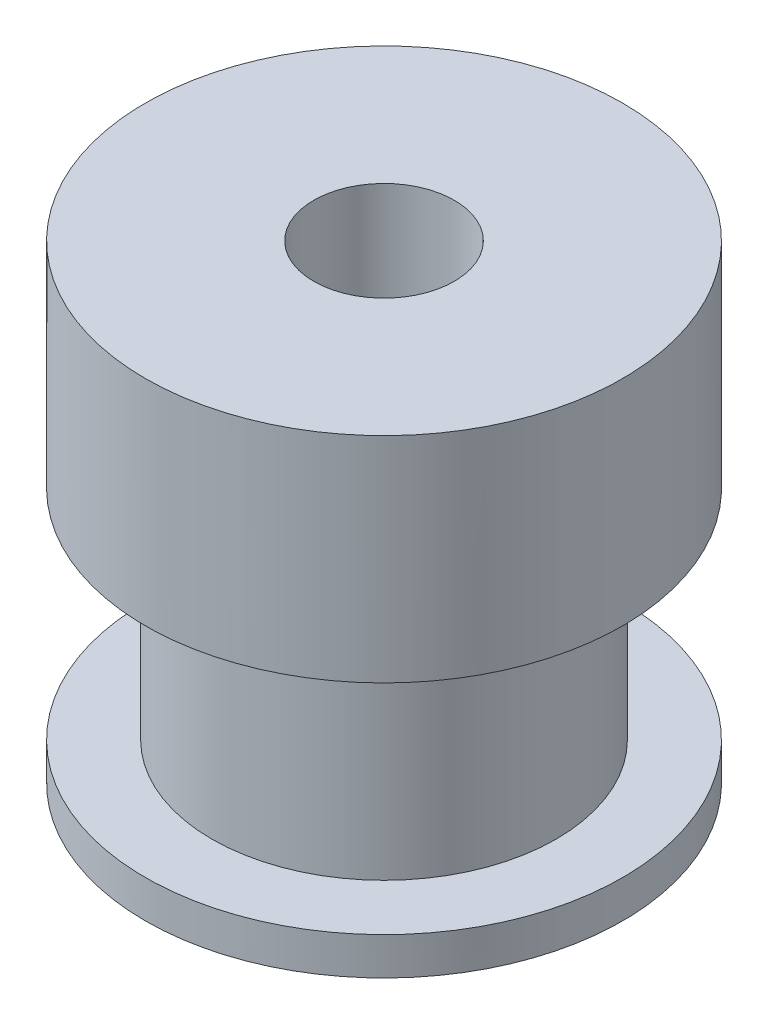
SolidWorks part; units mm, degrees
ref_plane "Front Plane" through (0, 0, 0) normal (0, 0, 1) x (1, 0, 0)
ref_plane "Top Plane" through (0, 0, 0) normal (0, 1, 0) x (1, 0, 0)
ref_plane "Right Plane" through (0, 0, 0) normal (1, 0, 0) x (0, 0, -1)
sketch "Sketch1" plane through (0, 0, 0) normal (0, 1, 0) x (1, 0, 0)
  circle A0 centre (0, 0) radius 8.0645
  dimension "D1" = 16.129
extrude "Boss-Extrude1" add sketch "Sketch1" along normal blind 15.875
sketch "Sketch2" plane through (0, 0, 0) normal (1, 0, 0) x (0, 0, -1)
  line L0 (-8.0645, 15.875) -> (-8.0645, 0) construction
  line L1 (-8.0645, 1.27) -> (-5.8166, 1.27)
  line L2 (-8.0645, 1.27) -> (-8.0645, 8.636)
  line L3 (-8.0645, 8.636) -> (-5.8166, 8.636)
  line L4 (-5.8166, 1.27) -> (-5.8166, 8.636)
  line L5 (-8.0645, 0) -> (8.0645, 0) construction
  line L6 (0, 0) -> (0, 16.4659) construction
  dimension "D1" = 7.366
  dimension "D2" = 1.27
  dimension "D3" = 5.8166
revolve "Cut-Revolve1" cut sketch "Sketch2" angle 360 about L6
sketch "Sketch3" plane through (0, 15.875, 0) normal (0, 1, 0) x (1, 0, 0)
  circle A0 centre (0, 0) radius 2.3749
  dimension "D1" = 4.7498
extrude "Cut-Extrude1" cut sketch "Sketch3" against normal through all
